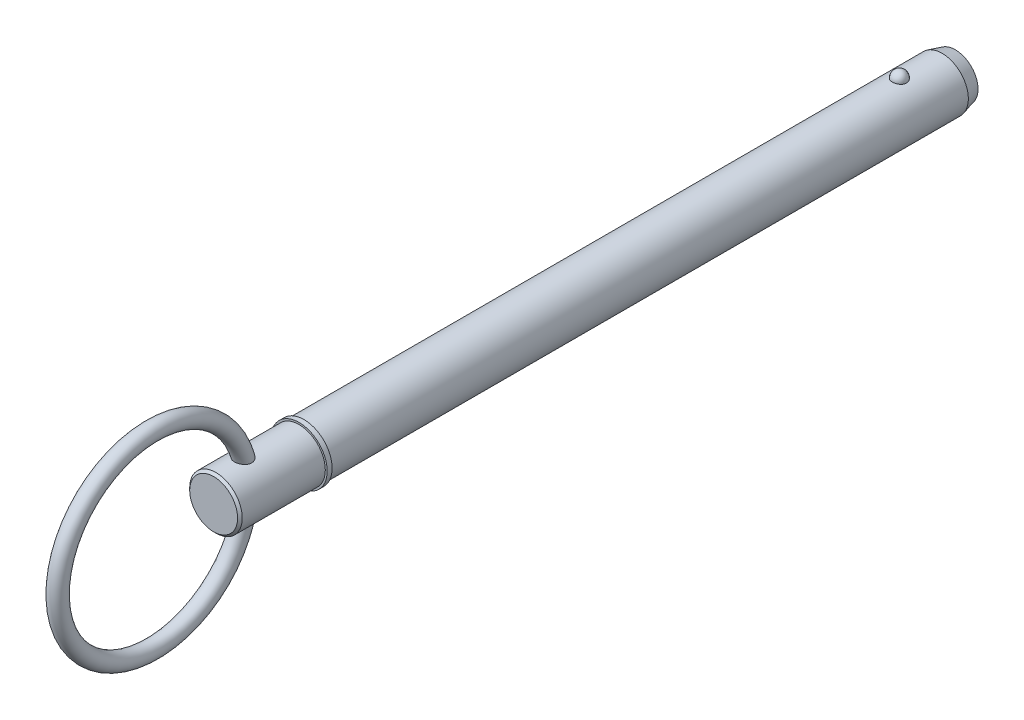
SolidWorks part; units mm, degrees
ref_plane "Front Plane" through (0, 0, 0) normal (0, 0, 1) x (1, 0, 0)
ref_plane "Top Plane" through (0, 0, 0) normal (0, 1, 0) x (1, 0, 0)
ref_plane "Right Plane" through (0, 0, 0) normal (1, 0, 0) x (0, 0, -1)
sketch "Sketch2" plane through (0, 0, 0) normal (0, 0, 1) x (1, 0, 0)
  circle A0 centre (0, 0) radius 7.94
  point P3 (0, 7.94)
  dimension "D1" = 15.88
extrude "Boss-Extrude1" add sketch "Sketch2" along normal blind 177.8
sketch "Sketch3" plane through (0, 0, 0) normal (0, 0, -1) x (-1, 0, 0)
  circle A0 centre (0, 0) radius 7.94
  dimension "D1" = 15.88
extrude "Boss-Extrude2" add sketch "Sketch3" along normal blind 19.05
chamfer "Chamfer1" distance 4 angle 15 1 edges at (-7.94, 0, -19.05)
sketch "Sketch18" plane through (0, 0, 0) normal (1, 0, 0) x (0, 0, -1)
  line L0 (15.05, 7.94) -> (-177.8, 7.94) construction
  line L1 (2.15, 10.09) -> (2.15, 5.79)
  line L2 (-177.8, -7.94) -> (15.05, -7.94) construction
  arc A0 (2.15, 10.09) -> (2.15, 5.79) centre (2.15, 7.94) ccw
  point P4 (0, 7.94)
  dimension "D1" = 18.03
revolve "Revolve1" add sketch "Sketch18" angle 360 about L1
sketch "Sketch19" plane through (0, 0, 0) normal (1, 0, 0) x (0, 0, -1)
  line L0 (-33.7288, 0) -> (-46.4542, 0) construction
sketch "Sketch20" plane through (0, 0, 0) normal (1, 0, 0) x (0, 0, -1)
  line L0 (-177.8, 0) -> (-177.8, 8.5)
  line L1 (-177.8, 7.94) -> (-177.8, -7.94) construction
  line L2 (-177.8, 8.5) -> (-179.3, 8.5)
  line L3 (-179.3, 8.5) -> (-179.3, 0)
  line L4 (-33.7288, 0) -> (-46.4542, 0) construction
  line L5 (-179.3, 0) -> (-177.8, 0)
  dimension "D1" = 8.5
  dimension "D2" = 1.5
revolve "Revolve2" add sketch "Sketch20" angle 360 about L0
sketch "Sketch21" plane through (0, 0, 177.8) normal (0, 0, -1) x (-1, 0, 0)
  circle A0 centre (0, 0) radius 7.94
  dimension "D1" = 15.88
extrude "Boss-Extrude3" add sketch "Sketch21" against normal blind 27.31
chamfer "Chamfer2" distance 0.7 angle 45 1 edges at (-7.94, 0, 205.11)
sketch "Sketch23" plane through (0, 0, 0) normal (1, 0, 0) x (0, 0, -1)
  line L0 (-205.11, 7.24) -> (-205.11, -7.24) construction
  circle A0 centre (-223.685, 0) radius 28.575
  point P2 (-195.11, 0)
  dimension "D1" = 57.15
  dimension "D2" = 10
sketch "Sketch24" plane through (0, 0, 0) normal (0, 1, 0) x (1, 0, 0)
  circle A0 centre (0, -195.11) radius 2.5
  dimension "D1" = 5
sweep "Sweep1" add profiles "Sketch24" path "Sketch23"
